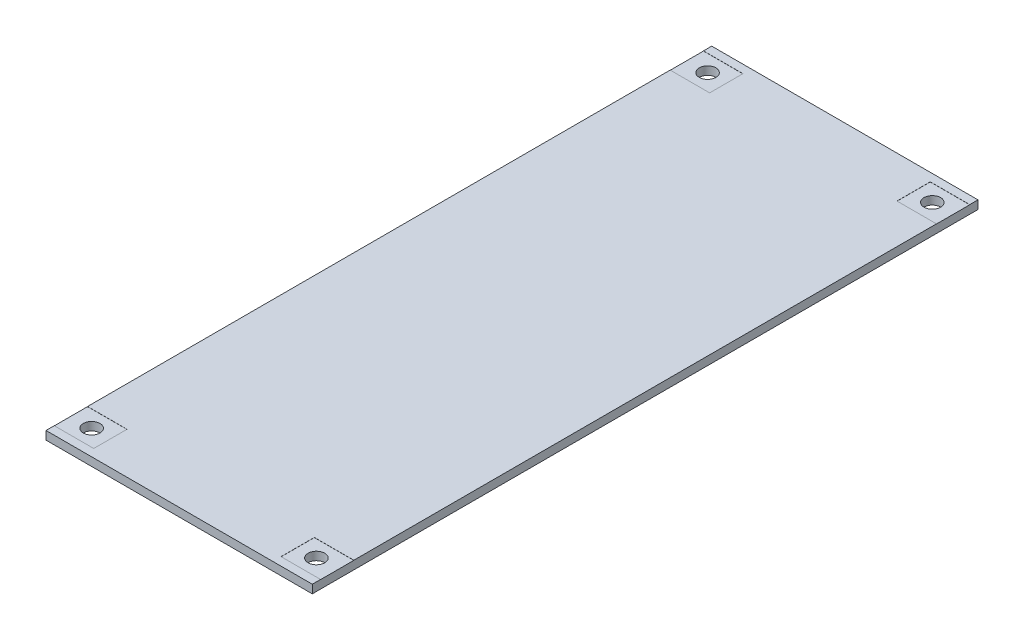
SolidWorks part; units mm, degrees
ref_plane "Front Plane" through (0, 0, 0) normal (0, 0, 1) x (1, 0, 0)
ref_plane "Top Plane" through (0, 0, 0) normal (0, 1, 0) x (1, 0, 0)
ref_plane "Right Plane" through (0, 0, 0) normal (1, 0, 0) x (0, 0, -1)
sketch "Sketch1" plane through (0, 0, 0) normal (0, 1, 0) x (1, 0, 0)
  line L1 (0, 0) -> (50.8, 0)
  line L2 (0, 0) -> (0, 127)
  line L3 (0, 127) -> (50.8, 127)
  line L4 (50.8, 0) -> (50.8, 127)
  circle A0 centre (3.9624, 4.7498) radius 1.5875
  circle A1 centre (46.84, 4.7498) radius 1.5875
  circle A2 centre (3.9624, 122.2502) radius 1.5875
  circle A3 centre (46.8376, 122.2502) radius 1.5875
  dimension "D1" = 3.9624
  dimension "D3" = 4.7498
  dimension "D7" = 4.7498
  dimension "D2" = 4.7498
  dimension "D4" = 3.96
  dimension "D5" = 50.8
  dimension "D6" = 4.7498
  dimension "D8" = 3.9624
extrude "Boss-Extrude1" add sketch "Sketch1" along normal blind 1.6002
sketch "Sketch2" plane through (0, 1.6002, 0) normal (0, 1, 0) x (1, 0, 0)
  line L0 (0, 127) -> (0, 0) construction
  line L1 (0.3937, 1.5748) -> (7.5311, 1.5748)
  line L2 (0.3937, 119.0752) -> (7.5311, 119.0752)
  line L3 (0.3937, 7.9248) -> (7.5311, 7.9248)
  line L4 (7.5311, 1.5748) -> (7.5311, 7.9248)
  line L5 (0.3937, 1.5748) -> (7.5311, 7.9248) construction
  line L6 (0.3937, 7.9248) -> (7.5311, 1.5748) construction
  line L7 (0.3937, 7.9248) -> (0, 7.9248)
  line L8 (0.3937, 125.4252) -> (7.5311, 125.4252)
  line L9 (0.3937, 1.5748) -> (0, 1.5748)
  line L10 (0, 7.9248) -> (0, 1.5748)
  line L11 (7.5311, 119.0752) -> (7.5311, 125.4252)
  line L12 (0.3937, 119.0752) -> (7.5311, 125.4252) construction
  line L13 (0.3937, 125.4252) -> (7.5311, 119.0752) construction
  line L14 (0.3937, 125.4252) -> (0, 125.4252)
  line L15 (0.3937, 119.0752) -> (0, 119.0752)
  line L16 (0, 125.4252) -> (0, 119.0752)
  line L17 (50.8, 127) -> (0, 127) construction
  line L18 (50.4063, 125.4252) -> (43.2689, 125.4252)
  line L19 (50.4063, 119.0752) -> (43.2689, 119.0752)
  line L20 (43.2689, 125.4252) -> (43.2689, 119.0752)
  line L21 (50.4063, 125.4252) -> (43.2689, 119.0752) construction
  line L22 (50.4063, 119.0752) -> (43.2689, 125.4252) construction
  line L23 (50.4063, 119.0752) -> (50.8, 119.0752)
  line L24 (50.4063, 125.4252) -> (50.8, 125.4252)
  line L25 (50.8, 119.0752) -> (50.8, 125.4252)
  line L26 (50.8, 0) -> (50.8, 127) construction
  line L27 (50.4063, 7.9248) -> (43.2689, 7.9248)
  line L28 (50.4063, 1.5748) -> (43.2689, 1.5748)
  line L29 (43.2689, 7.9248) -> (43.2689, 1.5748)
  line L30 (50.4063, 7.9248) -> (43.2689, 1.5748) construction
  line L31 (50.4063, 1.5748) -> (43.2689, 7.9248) construction
  line L32 (50.4063, 1.5748) -> (50.8, 1.5748)
  line L33 (50.4063, 7.9248) -> (50.8, 7.9248)
  line L34 (50.8, 1.5748) -> (50.8, 7.9248)
  line L35 (0, 0) -> (50.8, 0) construction
  point P2 (3.9624, 4.7498)
  point P12 (3.9624, 122.2502)
  point P21 (46.8376, 122.2502)
  point P30 (46.8376, 4.7498)
  dimension "D1" = 4.7498
  dimension "D2" = 3.9624
  dimension "D3" = 4.7498
  dimension "D4" = 3.9624
  dimension "D5" = 3.9624
  dimension "D6" = 4.7498
extrude "Cut-Extrude1" cut sketch "Sketch2" against normal blind 0.0254
